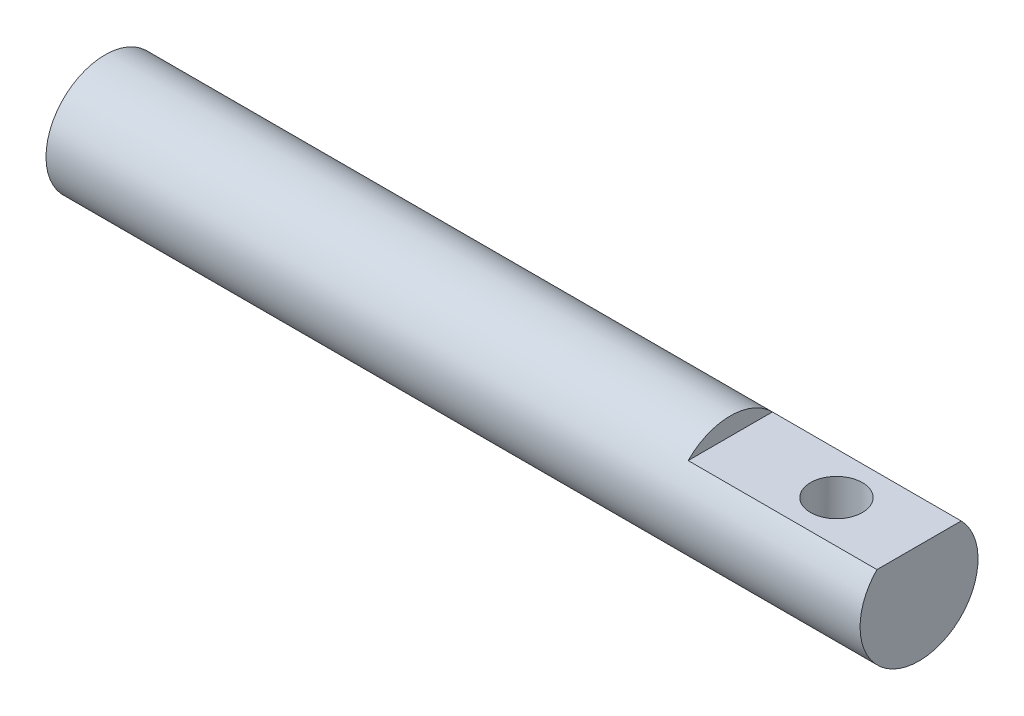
SolidWorks part; units mm, degrees
ref_plane "前视基准面" through (0, 0, 0) normal (0, 0, 1) x (1, 0, 0)
ref_plane "上视基准面" through (0, 0, 0) normal (0, 1, 0) x (1, 0, 0)
ref_plane "右视基准面" through (0, 0, 0) normal (1, 0, 0) x (0, 0, -1)
sketch "草图1" plane through (0, 0, 0) normal (0, 0, 1) x (1, 0, 0)
  line L0 (-69, 10) -> (69, 10)
  line L1 (-69, 10) -> (-69, 6)
  line L2 (-69, 6) -> (-55, 6)
  line L3 (-55, 6) -> (-55, 7)
  line L4 (-55, 7) -> (-19, 7)
  line L5 (-19, 7) -> (-19, 0)
  line L6 (-19, 0) -> (69, 0)
  line L7 (69, 0) -> (69, 10)
  line L8 (-90.4664, 0) -> (104.5296, 0) construction
revolve "旋转1" add sketch "草图1" angle 360 about L8
sketch "草图2" plane through (69, 0, 0) normal (1, 0, 0) x (0, 0, -1)
  line L0 (-7.1414, 7) -> (7.1414, 7)
  arc A0 (-7.1414, 7) -> (7.1414, 7) centre (0, 0) cw
  dimension "D1" = 7
extrude "切除-拉伸1" cut sketch "草图2" against normal blind 32
sketch "草图3" plane through (0, 7, 0) normal (0, 1, 0) x (1, 0, 0)
  line L0 (69, -7.1414) -> (69, 7.1414) construction
  point P0 (55, 0)
  point P1 (69, 0)
  dimension "D1" = 14
hole_wizard "M10x1.25 螺纹孔1" positions "3D草图1" profile "草图4" tap size "M10x1.25" standard "GB"
sketch3d "3D草图1"
  point P0 (55, 7, 0)
sketch "草图4" plane through (55, 7, 0) normal (1, 0, 0) x (0, 0, 1)
  line L0 (0, 0) -> (0, 17)
  line L1 (0, 17) -> (4.4, 17)
  line L2 (4.4, 17) -> (4.4, 0)
  line L5 (4.4, 0) -> (0, 0)
  line L11 (0, -6.35) -> (0, 107.95) construction
  dimension "籵謂蹟恇謂郰芛眻噤" = 8.8
  dimension "籵謂蹟恇謂郰芛旮僅" = 17
ref_plane "基准面1" through (0, -10, 0) normal (0, 1, 0) x (-1, 0, 0)
sketch "草图5" plane through (0, -10, 0) normal (0, 1, 0) x (-1, 0, 0)
  line L0 (0, 27.2683) -> (0, -25.1885) construction
  line L2 (40.7869, 0) -> (-37.7828, 0) construction
  line L3 (4, 4) -> (-4, 4)
  line L5 (4, -4) -> (-4, -4)
  arc A0 (4, -4) -> (4, 4) centre (4, 0) ccw
  arc A1 (-4, 4) -> (-4, -4) centre (-4, 0) ccw
extrude "切除-拉伸2" cut sketch "草图5" along normal blind 4
sketch "草图7" plane through (0, -6, 0) normal (0, -1, 0) x (1, 0, 0)
  point P0 (0, 0)
hole_wizard "M3 螺纹孔1" positions "3D草图3" profile "草图8" tap size "M3" standard "GB"
sketch3d "3D草图3"
  point P0 (0, -6, 0)
sketch "草图8" plane through (0, -6, 0) normal (1, 0, 0) x (0, 0, -1)
  line L0 (0, 0) -> (0, 9.2511)
  line L1 (0, 9.2511) -> (1.25, 8.5)
  line L2 (1.25, 8.5) -> (1.25, 0)
  line L5 (1.25, 0) -> (0, 0)
  line L10 (0, 9.2511) -> (-1.25, 8.5) construction
  line L11 (0, -6.35) -> (0, 107.95) construction
  dimension "蹟恇謂郰芛眻噤" = 2.5
  dimension "蹟恇謂郰芛旮僅" = 8.5
  dimension "絳芛褒僅" = 118
